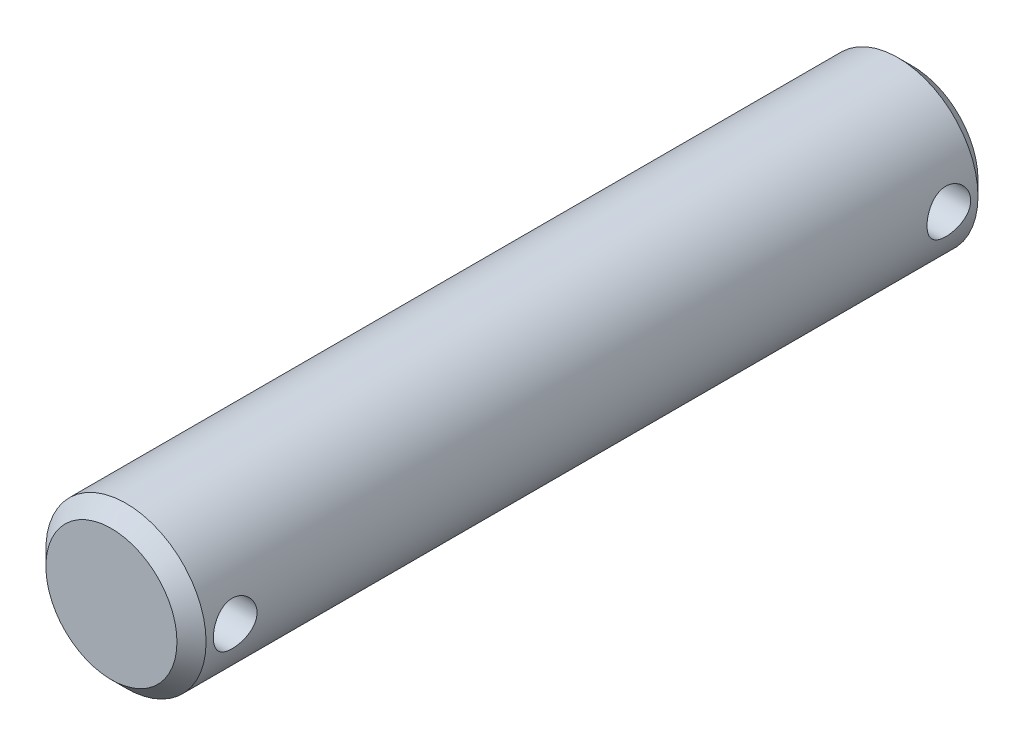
SolidWorks part; units mm, degrees
ref_plane "Face" through (0, 0, 0) normal (0, 0, 1) x (1, 0, 0)
ref_plane "Dessus" through (0, 0, 0) normal (0, 1, 0) x (1, 0, 0)
ref_plane "Droite" through (0, 0, 0) normal (1, 0, 0) x (0, 0, -1)
sketch "Esquisse1" plane through (0, 0, 0) normal (0, 0, 1) x (1, 0, 0)
  circle A0 centre (0, 0) radius 11
  dimension "D1" = 22
extrude "Base-Extrusion" add sketch "Esquisse1" against normal blind 110
chamfer "Chanfrein1" distance 2 angle 45
sketch "Esquisse2" plane through (0, 0, 0) normal (1, 0, 0) x (0, 0, -1)
  line L0 (108, 0) -> (2, 0) construction
  line L1 (110, -9) -> (110, 9) construction
  line L2 (0, 9) -> (0, -9) construction
  circle A0 centre (6, 0) radius 3
  circle A1 centre (104, 0) radius 3
  dimension "D1" = 6
  dimension "D2" = 6
  dimension "D3" = 6
extrude "Enlèv. mat.-Extru.1" cut sketch "Esquisse2" against normal mid plane 100
